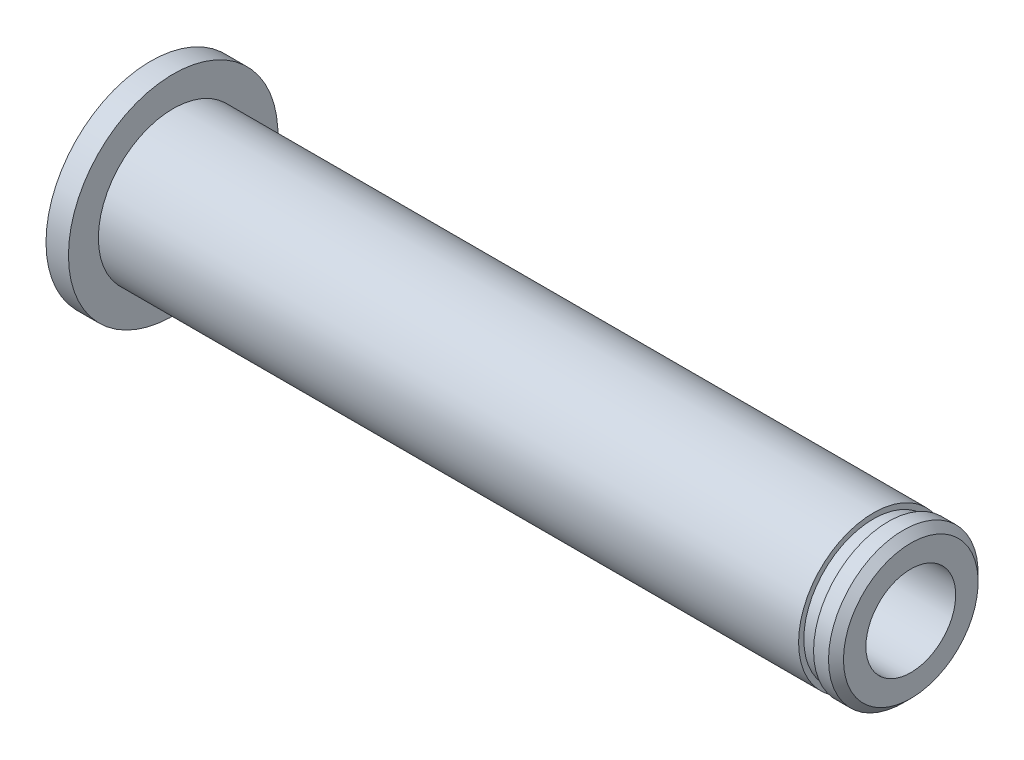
SolidWorks part; units mm, degrees
ref_plane "Plan de face" through (0, 0, 0) normal (0, 0, 1) x (1, 0, 0)
ref_plane "Plan de dessus" through (0, 0, 0) normal (0, 1, 0) x (1, 0, 0)
ref_plane "Plan de droite" through (0, 0, 0) normal (1, 0, 0) x (0, 0, -1)
sketch "Esquisse1" plane through (0, 0, 0) normal (0, 0, 1) x (1, 0, 0)
  line L0 (0, 3) -> (0, 7)
  line L1 (0, 7) -> (1.5, 7)
  line L2 (1.5, 7) -> (1.5, 5)
  line L3 (1.5, 5) -> (48.3, 5)
  line L4 (48.3, 5) -> (48.3, 4.65)
  line L5 (48.3, 4.65) -> (49.3, 4.65)
  line L6 (49.3, 4.65) -> (49.3, 5)
  line L7 (49.3, 5) -> (50.3, 5)
  line L8 (50.8, 4.5) -> (50.8, 3)
  line L9 (50.8, 3) -> (0, 3)
  line L10 (0, 0) -> (56.3694, 0) construction
  line L11 (50.3, 5) -> (50.8, 4.5)
  point P10 (50.8, 5)
  point P13 (0.75, 7)
  dimension "D1" = 10
  dimension "D2" = 6
  dimension "D3" = 14
  dimension "D4" = 1.5
  dimension "D5" = 9.3
  dimension "D6" = 1.5
  dimension "D7" = 1
  dimension "D8" = 50.8
  dimension "D9" = 46.8
revolve "Révolution1" add sketch "Esquisse1" angle 360 about L10
